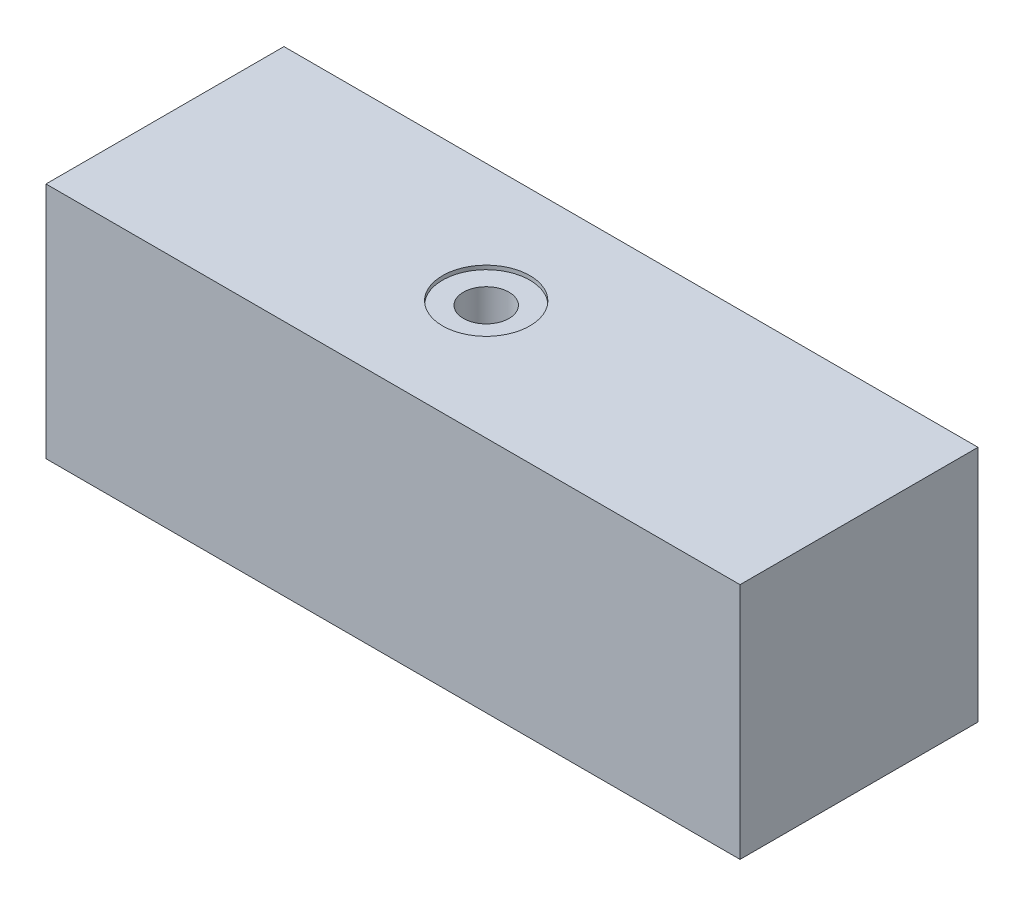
SolidWorks part; units mm, degrees
ref_plane "Plan de face" through (0, 0, 0) normal (0, 0, 1) x (1, 0, 0)
ref_plane "Plan de dessus" through (0, 0, 0) normal (0, 1, 0) x (1, 0, 0)
ref_plane "Plan de droite" through (0, 0, 0) normal (1, 0, 0) x (0, 0, -1)
sketch "Esquisse1" plane through (0, 0, 0) normal (0, 0, 1) x (1, 0, 0)
  line L0 (-87.5, 34) -> (-87.5, -26)
  line L1 (87.5, -26) -> (87.5, 34)
  line L2 (87.5, 34) -> (-87.5, 34)
  line L3 (-87.5, -26) -> (87.5, -26)
  dimension "D1" = 60
  dimension "D2" = 175
  dimension "D3" = 87.5
extrude "Extrusion1" add sketch "Esquisse1" along normal blind 60
hole_wizard "Perçage1" positions "Esquisse3D1" profile "Esquisse3" legacy
sketch3d "Esquisse3D1"
  line L0 (-87.5, 34, 60) -> (-87.5, 34, 0) construction
  line L1 (87.5, 34, 60) -> (-87.5, 34, 60) construction
  point P0 (-6.5, 34, 30)
  dimension "D1" = 81
  dimension "D2" = 30
sketch "Esquisse3" plane through (-6.5, 34, 30) normal (1, 0, 0) x (0, 0, 1)
  line L0 (0, 0) -> (0, 60)
  line L1 (0, 60) -> (5.75, 60)
  line L2 (5.75, 60) -> (5.75, 1)
  line L3 (5.75, 1) -> (11, 1)
  line L4 (11, 1) -> (11, 0)
  line L5 (11, 0) -> (0, 0)
  line L6 (0, 110) -> (0, -10) construction
  dimension "Diamètre" = 11.5
  dimension "Profondeur" = 60
  dimension "Diamètre chambrage" = 22
  dimension "Profondeur chambrage" = 1
